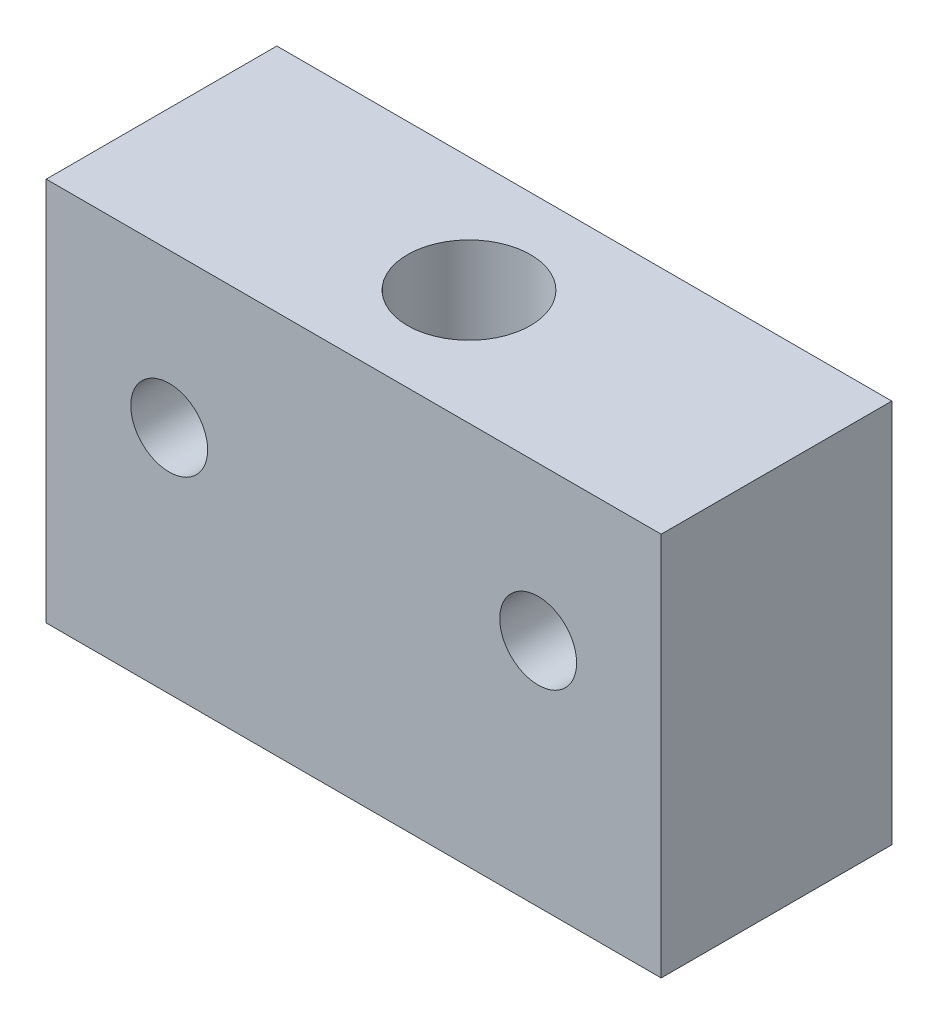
SolidWorks part; units mm, degrees
ref_plane "Face" through (0, 0, 0) normal (0, 0, 1) x (1, 0, 0)
ref_plane "Dessus" through (0, 0, 0) normal (0, 1, 0) x (1, 0, 0)
ref_plane "Droite" through (0, 0, 0) normal (1, 0, 0) x (0, 0, -1)
sketch "Esquisse1" plane through (0, 0, 0) normal (0, 0, 1) x (1, 0, 0)
  line L1 (-69.9731, 23.6234) -> (-29.9731, 23.6234)
  line L2 (-69.9731, 23.6234) -> (-69.9731, -1.3766)
  line L3 (-69.9731, -1.3766) -> (-29.9731, -1.3766)
  line L4 (-29.9731, 23.6234) -> (-29.9731, -1.3766)
  dimension "D1" = 40
  dimension "D2" = 25
extrude "Base-Extrusion" add sketch "Esquisse1" along normal blind 15
sketch "Esquisse2" plane through (0, 23.6234, 0) normal (0, 1, 0) x (-1, 0, 0)
  line L0 (29.9731, 15) -> (69.9731, 15) construction
  line L1 (29.9731, 15) -> (29.9731, 0) construction
  circle A0 centre (49.9731, 7.5) radius 4
  dimension "D1" = 8
  dimension "D2" = 7.5
  dimension "D3" = 20
extrude "Enlèv. mat.-Extru.1" cut sketch "Esquisse2" against normal blind 35
hole_wizard "Trou taraudé M6x1.01" positions "Esquisse4" profile "Esquisse3" tap size "M6x1.0" standard "ISO"
sketch "Esquisse4" plane through (0, 0, 15) normal (0, 0, 1) x (1, 0, 0)
  line L0 (-69.9731, 23.6234) -> (-69.9731, -1.3766) construction
  line L1 (-29.9731, -1.3766) -> (-29.9731, 23.6234) construction
  line L2 (-69.9731, -1.3766) -> (-29.9731, -1.3766) construction
  point P0 (-61.9731, 13.6234)
  point P1 (-37.9731, 13.6234)
  dimension "D1" = 8
  dimension "D2" = 8
  dimension "D3" = 15
  dimension "D4" = 15
sketch "Esquisse3" plane through (-61.9731, 13.6234, 15) normal (1, 0, 0) x (0, -1, 0)
  line L0 (0, 0) -> (0, 21.5022)
  line L1 (0, 21.5022) -> (2.5, 20)
  line L2 (2.5, 20) -> (2.5, 0)
  line L5 (2.5, 0) -> (0, 0)
  line L10 (0, 21.5022) -> (-2.5, 20) construction
  line L11 (0, -6.35) -> (0, 107.95) construction
  dimension "Diamètre du perçage" = 5
  dimension "Profondeur du perçage" = 20
  dimension "Angle de pointe" = 118
